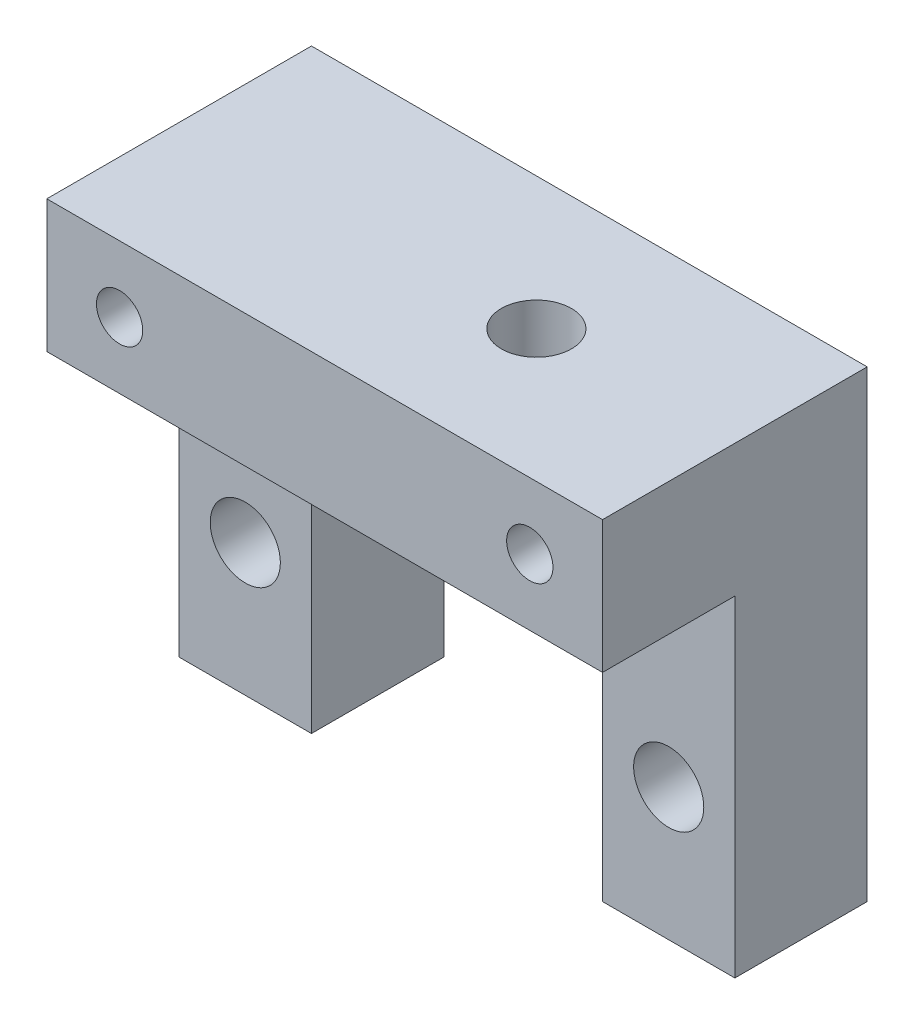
SolidWorks part; units mm, degrees
ref_plane "Ebene vorne" through (0, 0, 0) normal (0, 0, 1) x (1, 0, 0)
ref_plane "Ebene oben" through (0, 0, 0) normal (0, 1, 0) x (1, 0, 0)
ref_plane "Ebene rechts" through (0, 0, 0) normal (1, 0, 0) x (0, 0, -1)
sketch "Skizze1" plane through (0, 0, 0) normal (0, 1, 0) x (1, 0, 0)
  line L3 (21, -9.4493) -> (-21, -9.4493)
  line L4 (21, -9.4493) -> (21, 10.5507)
  line L5 (21, 10.5507) -> (-21, 10.5507)
  line L6 (-21, -9.4493) -> (-21, 10.5507)
  dimension "D2" = 42
  dimension "D3" = 20
extrude "Aufsatz-Linear austragen1" add sketch "Skizze1" along normal blind 10
sketch "Skizze2" plane through (0, 0, 9.4493) normal (0, 0, 1) x (1, 0, 0)
  line L0 (-21, 10) -> (-21, 0) construction
  circle A0 centre (-15.5, 5) radius 1.75
  circle A1 centre (15.5, 5) radius 1.75
  point P0 (-21, 5)
  dimension "D1" = 5.5
extrude "Schnitt-Linear austragen1" cut sketch "Skizze2" against normal blind 20
sketch "Skizze3" plane through (0, 10, 0) normal (0, 1, 0) x (1, 0, 0)
  line L0 (21, -9.4493) -> (21, 10.5507) construction
  circle A0 centre (6, 0.5507) radius 2.65
  point P0 (21, 0.5507)
  dimension "D2" = 5.3
  dimension "D1" = 15
extrude "Schnitt-Linear austragen2" cut sketch "Skizze3" against normal blind 10
sketch "Skizze4" plane through (0, 0, 0) normal (0, -1, 0) x (-1, 0, 0)
  line L0 (-21, 0.5507) -> (-11, 0.5507)
  line L1 (-21, -9.4493) -> (-21, 10.5507) construction
  line L2 (-11, 0.5507) -> (-11, 10.5507)
  line L3 (-21, 10.5507) -> (21, 10.5507) construction
  line L4 (-11, 10.5507) -> (-21, 10.5507)
  line L5 (-21, 10.5507) -> (-21, 0.5507)
  line L6 (21, 10.5507) -> (21, 0.5507)
  line L7 (21, 10.5507) -> (21, -9.4493) construction
  line L8 (21, 0.5507) -> (11, 0.5507)
  line L9 (11, 0.5507) -> (11, 10.5507)
  line L10 (11, 10.5507) -> (21, 10.5507)
  dimension "D1" = 10
  dimension "D2" = 10
extrude "Aufsatz-Linear austragen2" add sketch "Skizze4" along normal blind 25
sketch "Skizze5" plane through (0, 0, -0.5507) normal (0, 0, 1) x (1, 0, 0)
  circle A0 centre (16, -15) radius 2.65
  circle A1 centre (-16, -15) radius 2.65
extrude "Schnitt-Linear austragen3" cut sketch "Skizze5" against normal blind 10
